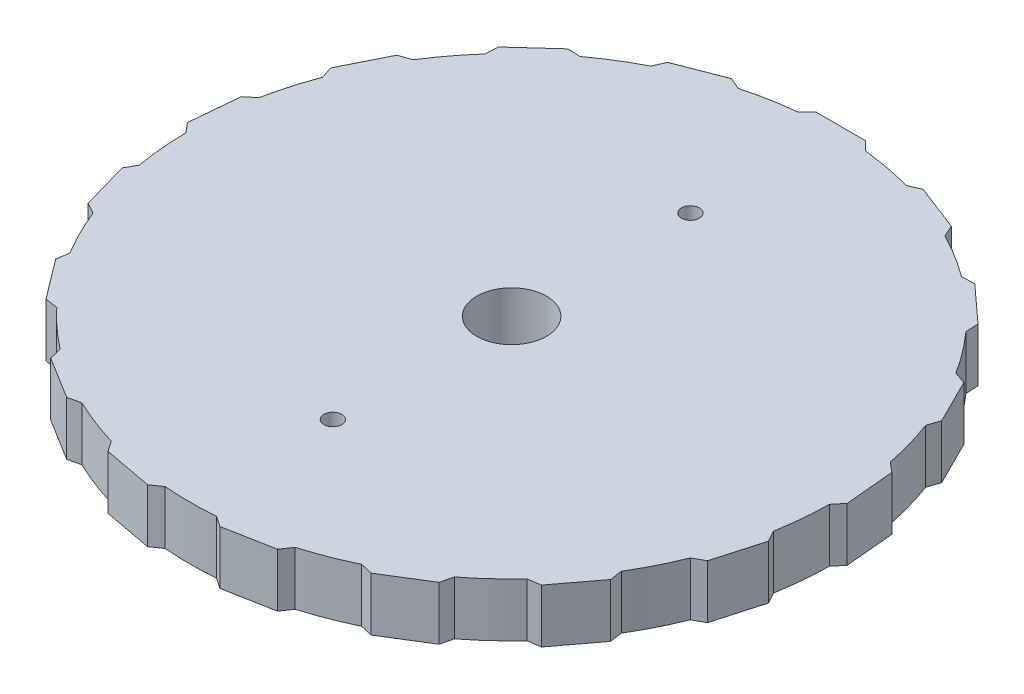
SolidWorks part; units mm, degrees
ref_plane "Front Plane" through (0, 0, 0) normal (0, 0, 1) x (1, 0, 0)
ref_plane "Top Plane" through (0, 0, 0) normal (0, 1, 0) x (1, 0, 0)
ref_plane "Right Plane" through (0, 0, 0) normal (1, 0, 0) x (0, 0, -1)
sketch "Sketch1" plane through (0, 0, 0) normal (0, 1, 0) x (1, 0, 0)
  line L0 (0, 1.95) -> (0, 18) construction
  line L1 (0, 0) -> (6.2639, 0) construction
  circle A0 centre (0, 0) radius 18
  circle A1 centre (0, 0) radius 1.95
  circle A2 centre (0, 10) radius 0.5
  circle A3 centre (0, 0) radius 10 construction
  circle A4 centre (0, -10) radius 0.5
  dimension "D1" = 36
  dimension "D2" = 3.9
  dimension "D3" = 1
  dimension "D4" = 20
  dimension "D5" = 10
extrude "Boss-Extrude1" add sketch "Sketch1" along normal blind 3
sketch "Sketch2" plane through (0, 0, 0) normal (0, 1, 0) x (1, 0, 0)
  line L0 (0, 0) -> (0, 18.4014) construction
  line L1 (-1.3815, 18.4014) -> (1.3815, 18.4014)
  line L2 (-1.3815, 18.4014) -> (-1.8815, 17.9014)
  line L3 (-1.8815, 17.9014) -> (1.8815, 17.9014)
  line L4 (1.8815, 17.9014) -> (1.3815, 18.4014)
  line L5 (-1.8815, 17.9014) -> (0, 0) construction
  line L6 (0, 0) -> (1.8815, 17.9014) construction
  line L7 (5.3591, 17.6578) -> (7.9356, 16.6597)
  line L8 (5.3591, 17.6578) -> (4.7123, 17.3722)
  line L9 (4.7123, 17.3722) -> (8.2212, 16.0129)
  line L10 (8.2212, 16.0129) -> (7.9356, 16.6597)
  line L11 (11.376, 14.5295) -> (13.4179, 12.6681)
  line L12 (11.376, 14.5295) -> (10.6696, 14.4969)
  line L13 (10.6696, 14.4969) -> (13.4505, 11.9617)
  line L14 (13.4505, 11.9617) -> (13.4179, 12.6681)
  line L15 (15.8565, 9.4389) -> (17.088, 6.9655)
  line L16 (15.8565, 9.4389) -> (15.186, 9.6636)
  line L17 (15.186, 9.6636) -> (16.8633, 6.2951)
  line L18 (16.8633, 6.2951) -> (17.088, 6.9655)
  line L19 (18.1954, 3.0735) -> (18.4504, 0.3222)
  line L20 (18.1954, 3.0735) -> (17.6514, 3.5252)
  line L21 (17.6514, 3.5252) -> (17.9986, -0.2218)
  line L22 (17.9986, -0.2218) -> (18.4504, 0.3222)
  line L23 (18.077, -3.707) -> (17.3209, -6.3646)
  line L24 (18.077, -3.707) -> (17.7329, -3.0893)
  line L25 (17.7329, -3.0893) -> (16.7031, -6.7086)
  line L26 (16.7031, -6.7086) -> (17.3209, -6.3646)
  line L27 (15.5172, -9.9868) -> (13.8521, -12.1918)
  line L28 (15.5172, -9.9868) -> (15.4195, -9.2865)
  line L29 (15.4195, -9.2865) -> (13.1518, -12.2895)
  line L30 (13.1518, -12.2895) -> (13.8521, -12.1918)
  line L31 (10.8617, -14.9179) -> (8.5125, -16.3725)
  line L32 (10.8617, -14.9179) -> (11.0236, -14.2296)
  line L33 (11.0236, -14.2296) -> (7.8242, -16.2106)
  line L34 (7.8242, -16.2106) -> (8.5125, -16.3725)
  line L35 (4.7392, -17.8342) -> (2.0233, -18.3419)
  line L36 (4.7392, -17.8342) -> (5.1388, -17.2509)
  line L37 (5.1388, -17.2509) -> (1.4399, -17.9423)
  line L38 (1.4399, -17.9423) -> (2.0233, -18.3419)
  line L39 (-2.0233, -18.3419) -> (-4.7392, -17.8342)
  line L40 (-2.0233, -18.3419) -> (-1.4399, -17.9423)
  line L41 (-1.4399, -17.9423) -> (-5.1388, -17.2509)
  line L42 (-5.1388, -17.2509) -> (-4.7392, -17.8342)
  line L43 (-8.5125, -16.3725) -> (-10.8617, -14.9179)
  line L44 (-8.5125, -16.3725) -> (-7.8242, -16.2106)
  line L45 (-7.8242, -16.2106) -> (-11.0236, -14.2296)
  line L46 (-11.0236, -14.2296) -> (-10.8617, -14.9179)
  line L47 (-13.8521, -12.1918) -> (-15.5172, -9.9868)
  line L48 (-13.8521, -12.1918) -> (-13.1518, -12.2895)
  line L49 (-13.1518, -12.2895) -> (-15.4195, -9.2865)
  line L50 (-15.4195, -9.2865) -> (-15.5172, -9.9868)
  line L51 (-17.3209, -6.3646) -> (-18.077, -3.707)
  line L52 (-17.3209, -6.3646) -> (-16.7031, -6.7086)
  line L53 (-16.7031, -6.7086) -> (-17.7329, -3.0893)
  line L54 (-17.7329, -3.0893) -> (-18.077, -3.707)
  line L55 (-18.4504, 0.3222) -> (-18.1954, 3.0735)
  line L56 (-18.4504, 0.3222) -> (-17.9986, -0.2218)
  line L57 (-17.9986, -0.2218) -> (-17.6514, 3.5252)
  line L58 (-17.6514, 3.5252) -> (-18.1954, 3.0735)
  line L59 (-17.088, 6.9655) -> (-15.8565, 9.4389)
  line L60 (-17.088, 6.9655) -> (-16.8633, 6.2951)
  line L61 (-16.8633, 6.2951) -> (-15.186, 9.6636)
  line L62 (-15.186, 9.6636) -> (-15.8565, 9.4389)
  line L63 (-13.4179, 12.6681) -> (-11.376, 14.5295)
  line L64 (-13.4179, 12.6681) -> (-13.4505, 11.9617)
  line L65 (-13.4505, 11.9617) -> (-10.6696, 14.4969)
  line L66 (-10.6696, 14.4969) -> (-11.376, 14.5295)
  line L67 (-7.9356, 16.6597) -> (-5.3591, 17.6578)
  line L68 (-7.9356, 16.6597) -> (-8.2212, 16.0129)
  line L69 (-8.2212, 16.0129) -> (-4.7123, 17.3722)
  line L70 (-4.7123, 17.3722) -> (-5.3591, 17.6578)
  circle A1 centre (0, 0) radius 18 construction
  point P6 (0, 18.4014)
  point P7 (0, 17.9014)
  point P16 (6.6474, 17.1588)
  point P17 (6.4667, 16.6926)
  point P22 (12.3969, 13.5988)
  point P23 (12.0601, 13.2293)
  point P28 (16.4723, 8.2022)
  point P29 (16.0247, 7.9793)
  point P34 (18.3229, 1.6979)
  point P35 (17.825, 1.6517)
  point P40 (17.6989, -5.0358)
  point P41 (17.218, -4.8989)
  point P46 (14.6846, -11.0893)
  point P47 (14.2856, -10.788)
  point P52 (9.6871, -15.6452)
  point P53 (9.4239, -15.2201)
  point P58 (3.3812, -18.0881)
  point P59 (3.2894, -17.5966)
  point P64 (-3.3812, -18.0881)
  point P65 (-3.2894, -17.5966)
  point P70 (-9.6871, -15.6452)
  point P71 (-9.4239, -15.2201)
  point P76 (-14.6846, -11.0893)
  point P77 (-14.2856, -10.788)
  point P82 (-17.6989, -5.0358)
  point P83 (-17.218, -4.8989)
  point P88 (-18.3229, 1.6979)
  point P89 (-17.825, 1.6517)
  point P94 (-16.4723, 8.2022)
  point P95 (-16.0247, 7.9793)
  point P100 (-12.3969, 13.5988)
  point P101 (-12.0601, 13.2293)
  point P106 (-6.6474, 17.1588)
  point P107 (-6.4667, 16.6926)
  dimension "D1" = 6
  dimension "D2" = 0.5
  dimension "D3" = 45
  dimension "D4" = 17
extrude "Boss-Extrude2" add sketch "Sketch2" along normal blind 3
